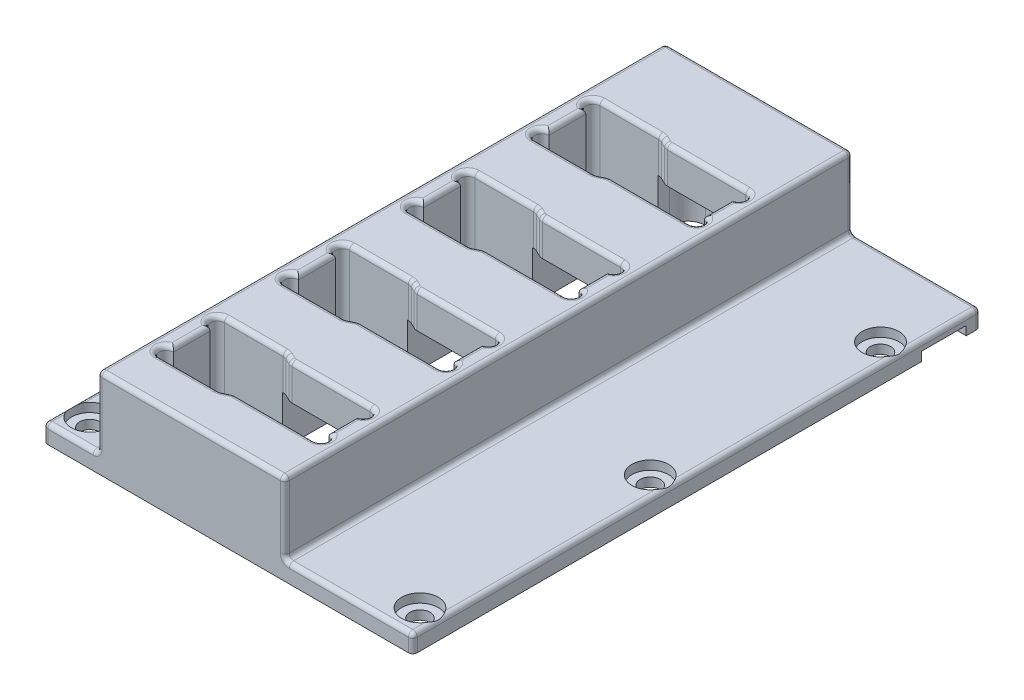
SolidWorks part; units mm, degrees
ref_plane "Front Plane" through (0, 0, 0) normal (0, 0, 1) x (1, 0, 0)
ref_plane "Top Plane" through (0, 0, 0) normal (0, 1, 0) x (1, 0, 0)
ref_plane "Right Plane" through (0, 0, 0) normal (1, 0, 0) x (0, 0, -1)
sketch "Sketch1" plane through (0, 0, 0) normal (0, 1, 0) x (1, 0, 0)
  line L1 (0, 0) -> (41.32, 0)
  line L2 (0, 0) -> (0, 56)
  line L3 (0, 56) -> (41.32, 56)
  line L4 (41.32, 0) -> (41.32, 56)
  dimension "D1" = 41.32
  dimension "D2" = 56
extrude "Extrude1" add sketch "Sketch1" along normal blind 2
sketch "Sketch3" plane through (0, 2, 0) normal (0, 1, 0) x (-1, 0, 0)
  line L0 (0, 0) -> (-41.32, 0) construction
  line L1 (-6.05, 0) -> (-27, 0)
  line L2 (-6.05, 0) -> (-6.05, -56)
  line L3 (-6.05, -56) -> (-27, -56)
  line L4 (-27, 0) -> (-27, -56)
  line L5 (-41.32, -56) -> (0, -56) construction
  line L6 (0, -56) -> (0, 0) construction
  dimension "D1" = 6.05
  dimension "D2" = 20.95
extrude "Extrude3" add sketch "Sketch3" along normal blind 8
sketch "Sketch4" plane through (0, 0, 0) normal (0, -1, 0) x (1, 0, 0)
  line L0 (41.32, -56) -> (0, -56) construction
  line L1 (14.55, -56) -> (24.97, -56)
  line L2 (14.55, -56) -> (14.55, 0)
  line L3 (14.55, 0) -> (24.97, 0)
  line L4 (24.97, -56) -> (24.97, 0)
  line L5 (0, 0) -> (41.32, 0) construction
  line L7 (41.32, 0) -> (41.32, -56) construction
  line L8 (0, -56) -> (0, 0) construction
  dimension "D1" = 16.35
  dimension "D2" = 14.55
extrude "Cut-Extrude1" cut sketch "Sketch4" against normal blind 6
sketch "Sketch5" plane through (0, 0, -56) normal (0, 0, -1) x (-1, 0, 0)
  line L0 (-14.55, 0) -> (-24.97, 0)
  line L12 (-24.97, 6) -> (-14.55, 6)
  line L13 (-14.55, 6) -> (-14.55, 0)
  line L14 (-14.55, 0) -> (0, 0)
  line L15 (0, 0) -> (0, 2)
  line L16 (0, 2) -> (-6.05, 2)
  line L17 (-6.05, 2) -> (-6.05, 10)
  line L18 (-6.05, 10) -> (-27, 10)
  line L19 (-27, 10) -> (-27, 2)
  line L20 (-27, 2) -> (-41.32, 2)
  line L21 (-41.32, 2) -> (-41.32, 0)
  line L22 (-41.32, 0) -> (-24.97, 0)
  line L23 (-24.97, 0) -> (-24.97, 6)
  line L26 (-14.55, 0) -> (0, 0)
  line L27 (0, 0) -> (0, 2)
  line L28 (0, 2) -> (-6.05, 2)
  line L29 (-6.05, 2) -> (-6.05, 10)
  line L30 (-6.05, 10) -> (-27, 10)
  line L31 (-27, 10) -> (-27, 2)
  line L32 (-27, 2) -> (-41.32, 2)
  line L33 (-41.32, 2) -> (-41.32, 0)
  line L34 (-41.32, 0) -> (-24.97, 0)
  dimension "D1" = 0
extrude "Extrude4" add sketch "Sketch5" along normal blind 6
sketch "Sketch6" plane through (0, 0, 0) normal (0, -1, 0) x (1, 0, 0)
  line L0 (0, -62) -> (0, 0) construction
  line L1 (41.32, -62) -> (0, -62)
  line L2 (41.32, -62) -> (41.32, -56)
  line L3 (41.32, -56) -> (0, -56)
  line L4 (0, -62) -> (0, -56)
extrude "Extrude5" [suppressed] add sketch "Sketch6" along normal blind 9.18
sketch "Sketch7" plane through (0, 0, 0) normal (0, 0, 1) x (1, 0, 0)
  line L12 (14.55, 0) -> (24.97, 0)
  line L24 (0, 0) -> (14.55, 0)
  line L25 (14.55, 0) -> (14.55, 6)
  line L26 (14.55, 6) -> (24.97, 6)
  line L27 (24.97, 6) -> (24.97, 0)
  line L28 (24.97, 0) -> (41.32, 0)
  line L29 (41.32, 0) -> (41.32, 2)
  line L30 (41.32, 2) -> (27, 2)
  line L31 (27, 2) -> (27, 10)
  line L32 (27, 10) -> (6.05, 10)
  line L33 (6.05, 10) -> (6.05, 2)
  line L34 (6.05, 2) -> (0, 2)
  line L35 (0, 2) -> (0, 0)
  line L36 (0, 0) -> (14.55, 0)
  line L40 (24.97, 0) -> (41.32, 0)
  line L41 (41.32, 0) -> (41.32, 2)
  line L42 (41.32, 2) -> (27, 2)
  line L43 (27, 2) -> (27, 10)
  line L44 (27, 10) -> (6.05, 10)
  line L45 (6.05, 10) -> (6.05, 2)
  line L46 (6.05, 2) -> (0, 2)
  line L47 (0, 2) -> (0, 0)
  dimension "D1" = 0
extrude "Extrude6" add sketch "Sketch7" along normal blind 1.5
sketch "Sketch8" plane through (0, 10, 0) normal (0, 1, 0) x (-1, 0, 0)
  line L1 (-24.3875, -52.175) -> (-24.875, -52.175)
  line L2 (-24.3875, -45.875) -> (-24.875, -45.875)
  line L3 (-27, 1.5) -> (-27, -62) construction
  line L4 (-24.975, -49.025) -> (-8.075, -49.025) construction
  line L5 (-8.075, -51.0875) -> (-8.075, -46.9625)
  line L7 (-24.975, -47.4486) -> (-24.975, -50.6014)
  line L9 (-16.1378, -45.875) -> (-24.3875, -45.875)
  line L10 (-15.7023, -45.7752) -> (-15.0813, -45.4748)
  line L11 (-8.075, -45.375) -> (-14.6458, -45.375)
  line L13 (-8.075, -52.675) -> (-14.6458, -52.675)
  line L14 (-16.1378, -52.175) -> (-24.3875, -52.175)
  line L15 (-15.7023, -52.2748) -> (-15.0813, -52.5752)
  arc A0 (-8.075, -46.9625) -> (-8.075, -45.375) centre (-8.075, -46.1688) ccw
  arc A1 (-8.075, -52.675) -> (-8.075, -51.0875) centre (-8.075, -51.8812) ccw
  arc A2 (-24.875, -45.875) -> (-24.975, -47.4486) centre (-24.875, -46.665) ccw
  arc A3 (-24.975, -50.6014) -> (-24.875, -52.175) centre (-24.875, -51.385) ccw
  arc A10 (-16.1378, -45.875) -> (-15.7023, -45.7752) centre (-16.1378, -44.875) ccw
  arc A11 (-14.6458, -45.375) -> (-15.0813, -45.4748) centre (-14.6458, -46.375) ccw
  arc A14 (-15.7023, -52.2748) -> (-16.1378, -52.175) centre (-16.1378, -53.175) ccw
  arc A15 (-15.0813, -52.5752) -> (-14.6458, -52.675) centre (-14.6458, -51.675) ccw
  dimension "D4" = 0.7937
  dimension "D5" = 0.7937
  dimension "D1" = 6.3
  dimension "D2" = 7.3
  dimension "D6" = 2.025
extrude "Cut-Extrude2" cut sketch "Sketch8" against normal up to next
pattern_linear "LPattern1" count 4 spacing 14 along (0, 0, 1) of "Cut-Extrude2"
sketch "Sketch10" [suppressed] plane through (0, 0, 0) normal (0, -1, 0) x (1, 0, 0)
  line L0 (24.97, -52.0643) -> (25.975, -52.0643)
  line L1 (24.97, -52.0643) -> (24.97, -3.9857)
  line L2 (24.97, -3.9857) -> (25.975, -3.9857)
  line L3 (25.975, -52.0643) -> (25.975, -3.9857)
extrude "Extrude7" [suppressed] add sketch "Sketch10" against normal up to surface (8 mm away)
sketch "Sketch11" plane through (0, 0, 0) normal (0, -1, 0) x (1, 0, 0)
  line L0 (8.075, -49.025) -> (0, -49.025) construction
  line L1 (8.075, -48.025) -> (4.075, -48.025)
  line L2 (8.075, -48.025) -> (8.075, -45.375)
  line L3 (8.075, -51.0875) -> (8.075, -46.9625) construction
  line L4 (4.075, -45.375) -> (8.075, -45.375)
  line L5 (0, -62) -> (0, 1.5) construction
  line L6 (8.075, -50.025) -> (4.075, -50.025)
  line L7 (8.075, -50.025) -> (8.075, -52.675)
  line L8 (8.075, -52.675) -> (4.075, -52.675)
  arc A0 (4.075, -45.375) -> (4.075, -48.025) centre (4.075, -46.7) ccw
  arc A1 (4.075, -50.025) -> (4.075, -52.675) centre (4.075, -51.35) ccw
  dimension "D1" = 1
  dimension "D2" = 1
extrude "Cut-Extrude3" cut sketch "Sketch11" against normal blind 1.5
pattern_linear "LPattern2" count 4 spacing 14 along (0, 0, 1) of "Cut-Extrude3"
fillet "Fillet1" radius 2 1 edges
fillet "Fillet2" radius 2 3 edges
fillet "Fillet4" radius 2 3 edges
fillet "Fillet5" radius 2 1 edges
fillet "Fillet12" radius 0.5 68 edges at (27, 10, -30.25) (16.525, 10, 1.5) (6.05, 10, -30.25) (16.525, 10, -62) (11.3604, 10, -52.675) (7.2812, 10, -51.8812) (8.075, 10, -49.025) (7.2812, 10, -46.1688) (11.3604, 10, -45.375) (14.8692, 10, -45.4003) (15.3918, 10, -45.625) (15.9144, 10, -45.8497) (20.5064, 10, -45.875) (25.6634, 10, -46.6149) (24.975, 10, -49.025) (25.6634, 10, -51.4351) (20.5064, 10, -52.175) (15.9144, 10, -52.2003) (15.3918, 10, -52.425) (14.8692, 10, -52.6497) (11.3604, 10, -38.675) (7.2812, 10, -37.8812) (8.075, 10, -35.025) (7.2812, 10, -32.1688) (11.3604, 10, -31.375) (14.8692, 10, -31.4003) (15.3918, 10, -31.625) (15.9144, 10, -31.8497) (20.5064, 10, -31.875) (25.6634, 10, -32.6149) (24.975, 10, -35.025) (25.6634, 10, -37.4351) (20.5064, 10, -38.175) (15.9144, 10, -38.2003) (15.3918, 10, -38.425) (14.8692, 10, -38.6497) (11.3604, 10, -24.675) (7.2812, 10, -23.8812) (8.075, 10, -21.025) (7.2812, 10, -18.1688) (11.3604, 10, -17.375) (14.8692, 10, -17.4003) (15.3918, 10, -17.625) (15.9144, 10, -17.8497) (20.5064, 10, -17.875) (25.6634, 10, -18.6149) (24.975, 10, -21.025) (25.6634, 10, -23.4351) (20.5064, 10, -24.175) (15.9144, 10, -24.2003) (15.3918, 10, -24.425) (14.8692, 10, -24.6497) (11.3604, 10, -10.675) (7.2812, 10, -9.8812) (8.075, 10, -7.025) (7.2812, 10, -4.1688) (11.3604, 10, -3.375) (14.8692, 10, -3.4003) (15.3918, 10, -3.625) (15.9144, 10, -3.8497) (20.5064, 10, -3.875) (25.6634, 10, -4.6149) (24.975, 10, -7.025) (25.6634, 10, -9.4351) (20.5064, 10, -10.175) (15.9144, 10, -10.2003) (15.3918, 10, -10.425) (14.8692, 10, -10.6497)
sketch "Sketch12" plane through (0, 2, 0) normal (0, 1, 0) x (-1, 0, 0)
  line L22 (-27, -62) -> (-41.32, -62) construction
  line L24 (0, -62) -> (0, 1.5) construction
  line L26 (-41.32, 1.5) -> (-41.32, -62) construction
  circle A0 centre (-39.12, -53) radius 1.13
  circle A1 centre (-39.12, -27.25) radius 1.13
  circle A2 centre (-39.12, -1.5) radius 1.13
  circle A3 centre (-2.2, -1.5) radius 1.13
  circle A4 centre (-2.2, -59) radius 1.13
  dimension "D1" = 9
  dimension "D3" = 2.2
  dimension "D4" = 2.2
  dimension "D5" = 2.2
  dimension "D6" = 2.2
  dimension "D2" = 25.75
extrude "Cut-Extrude4" cut sketch "Sketch12" against normal through all
sketch "Sketch13" plane through (0, 2, 0) normal (0, 1, 0) x (-1, 0, 0)
  line L1 (-27, -62) -> (-41.32, -62) construction
  line L4 (-41.32, 1.5) -> (-41.32, -62) construction
  circle A4 centre (-2.2, -59) radius 2.05
  circle A5 centre (-2.2, -1.5) radius 2.05
  circle A7 centre (-39.12, -1.5) radius 2.05
  circle A8 centre (-39.12, -27.25) radius 2.05
  circle A9 centre (-39.12, -53) radius 2.05
  dimension "D1" = 9
  dimension "D2" = 25.75
  dimension "D3" = 2.2
  dimension "D4" = 2.2
extrude "Cut-Extrude5" cut sketch "Sketch13" against normal blind 1
fillet "Fillet13" radius 0.5 1 edges at (0, 2, -30.25)
fillet "Fillet18" radius 0.5 1 edges at (41.32, 2, -30.25)
fillet "Fillet19" radius 0.5 1 edges
fillet "Fillet20" radius 0.5 6 edges at (27, 6, -62) (26.8536, 9.8536, -61.8536) (41.32, 0.75, -62) (41.1736, 1.8536, -62) (34.16, 2, -62) (27.1464, 2.1464, -62)
fillet "Fillet21" radius 0.5 6 edges at (26.8536, 9.8536, 1.3536) (34.16, 2, 1.5) (41.1736, 1.8536, 1.5) (27, 6, 1.5) (27.1464, 2.1464, 1.5) (41.32, 0.75, 1.5)
fillet "Fillet23" [suppressed] radius 0.5
fillet "Fillet24" radius 0.5 1 edges
fillet "Fillet25" radius 0.5 6 edges at (0, 0.75, -62) (6.1964, 9.8536, -61.8536) (3.025, 2, -62) (0.1464, 1.8536, -62) (6.05, 6, -62) (5.9036, 2.1464, -62)
fillet "Fillet26" radius 0.5 6 edges at (6.05, 6, 1.5) (6.1964, 9.8536, 1.3536) (0, 0.75, 1.5) (0.1464, 1.8536, 1.5) (3.025, 2, 1.5) (5.9036, 2.1464, 1.5)
sketch "Sketch14" plane through (0, 0, 0) normal (0, -1, 0) x (1, 0, 0)
  line L7 (4, -59.386) -> (4, -1)
  line L8 (36.6488, 0) -> (5, 0)
  line L9 (37.6488, -55.386) -> (37.6488, -1)
  line L10 (41.32, -60.386) -> (41.32, -55.386)
  line L11 (37.6488, -55.386) -> (41.32, -55.386)
  line L12 (37.6488, -60.386) -> (5, -60.386)
  line L13 (37.6488, -60.386) -> (41.32, -60.386)
  arc A0 (5, -60.386) -> (4, -59.386) centre (5, -59.386) cw
  arc A1 (5, 0) -> (4, -1) centre (5, -1) ccw
  arc A2 (37.6488, -1) -> (36.6488, 0) centre (36.6488, -1) ccw
  dimension "D1" = 1
  dimension "D2" = 1
  dimension "D3" = 1
extrude "Cut-Extrude6" cut sketch "Sketch14" against normal blind 0.5
sketch "Sketch15" plane through (0, 0.5, 0) normal (0, -1, 0) x (1, 0, 0)
  line L0 (41.32, -60.386) -> (41.32, -55.386) construction
  line L1 (41.32, -55.386) -> (26.32, -55.386)
  line L2 (41.32, -55.386) -> (41.32, -60.386)
  line L3 (41.32, -60.386) -> (26.32, -60.386)
  line L4 (24.32, -57.386) -> (24.32, -58.386)
  line L5 (5, -60.386) -> (41.32, -60.386) construction
  arc A0 (24.32, -57.386) -> (26.32, -55.386) centre (26.32, -57.386) cw
  arc A1 (26.32, -60.386) -> (24.32, -58.386) centre (26.32, -58.386) cw
  point P12 (24.32, -60.386)
  dimension "D1" = 2
  dimension "D2" = 15
extrude "Cut-Extrude7" cut sketch "Sketch15" against normal blind 0.5
sketch "Sketch17" plane through (0, 0, 0) normal (0, -1, 0) x (1, 0, 0)
  line L0 (4.075, -52.675) -> (14.55, -52.675) construction
  line L1 (8.075, -48.025) -> (7.2812, -48.025)
  line L2 (8.075, -48.025) -> (8.075, -45.375)
  line L3 (8.075, -45.375) -> (7.2812, -45.375)
  line L4 (7.2812, -48.025) -> (7.2812, -45.375)
  line L5 (8.075, -50.025) -> (7.2812, -50.025)
  line L6 (8.075, -50.025) -> (8.075, -52.675)
  line L7 (8.075, -52.675) -> (7.2812, -52.675)
  line L8 (7.2812, -50.025) -> (7.2812, -52.675)
  line L9 (8.075, -50.025) -> (4.075, -50.025) construction
  line L10 (4.075, -48.025) -> (8.075, -48.025) construction
  line L11 (8.075, -48.025) -> (8.075, -46.9625) construction
  line L12 (8.075, -51.0875) -> (8.075, -50.025) construction
  line L13 (14.55, -45.375) -> (4.075, -45.375) construction
  arc A0 (8.075, -51.0875) -> (8.075, -52.675) centre (8.075, -51.8812) ccw construction
  arc A1 (8.075, -45.375) -> (8.075, -46.9625) centre (8.075, -46.1688) ccw construction
sketch "Sketch19" plane through (0, 0.5, 0) normal (0, -1, 0) x (1, 0, 0)
  line L1 (4, -48.0229) -> (8.075, -48.0229)
  line L2 (4, -48.0229) -> (4, -50.025)
  line L3 (4, -50.025) -> (8.075, -50.025)
  line L4 (8.075, -48.0229) -> (8.075, -50.025)
extrude "Cut-Extrude9" cut sketch "Sketch19" against normal blind 0.5
pattern_linear "LPattern3" [suppressed] count 4 spacing 14
